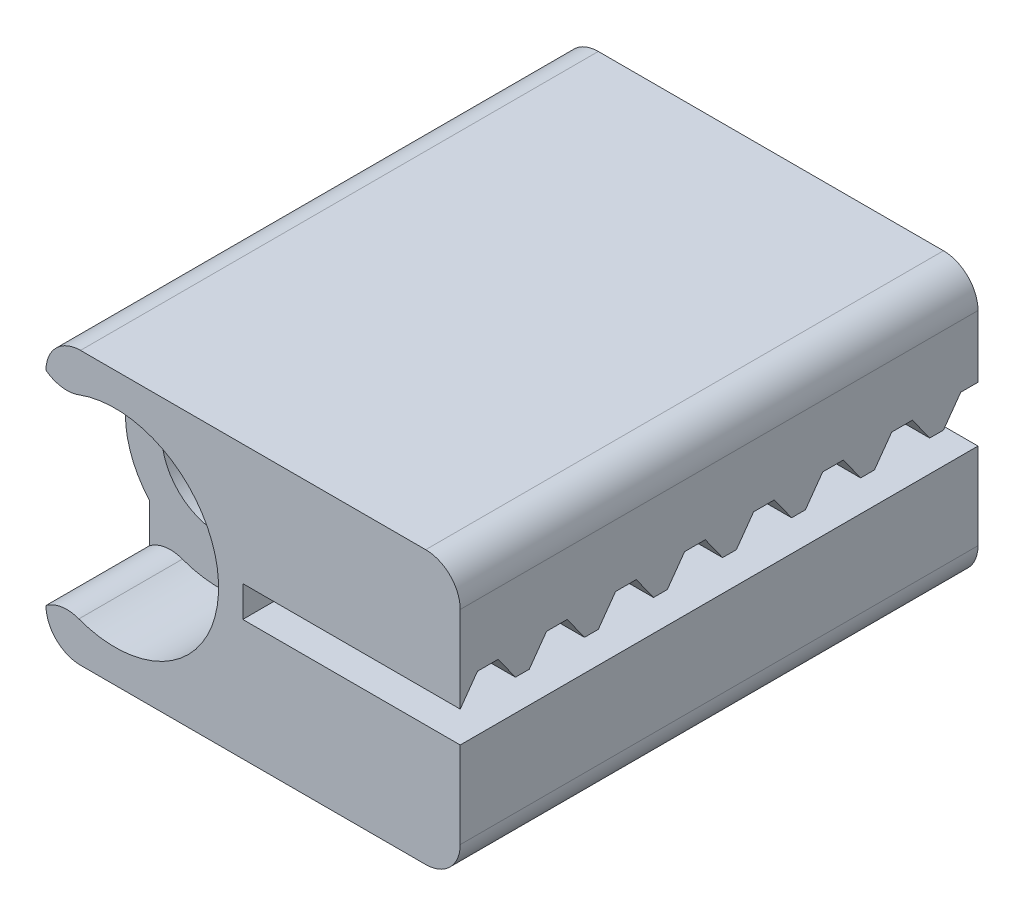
SolidWorks part; units mm, degrees
ref_plane "Спереди" through (0, 0, 0) normal (0, 0, 1) x (1, 0, 0)
ref_plane "Сверху" through (0, 0, 0) normal (0, 1, 0) x (1, 0, 0)
ref_plane "Справа" through (0, 0, 0) normal (1, 0, 0) x (0, 0, -1)
sketch "Эскиз1" plane through (0, 0, 0) normal (0, 0, 1) x (1, 0, 0)
  line L0 (0, 0) -> (0, 5.0449) construction
  line L1 (-5, -3.95) -> (5, -3.95)
  line L2 (-6, -2.95) -> (-6, -1.8138)
  line L3 (-5, 3.95) -> (5, 3.95)
  line L4 (6, -2.95) -> (6, 2.95)
  line L5 (-6, -3.95) -> (6, 3.95) construction
  line L6 (-6, 3.95) -> (6, -3.95) construction
  line L7 (0, 0) -> (-9.4958, 0) construction
  line L8 (-6, 1.8138) -> (-6, 2.95)
  arc A0 (-5, -3.95) -> (-6, -2.95) centre (-5, -2.95) cw
  arc A1 (5, -3.95) -> (6, -2.95) centre (5, -2.95) ccw
  arc A2 (5, 3.95) -> (6, 2.95) centre (5, 2.95) cw
  arc A3 (-6, 2.95) -> (-5, 3.95) centre (-5, 2.95) cw
  arc A4 (-6, 1.8138) -> (-6, -1.8138) centre (-4, 0) ccw
  circle A5 centre (-4, 0) radius 1.65
  point P0 (0, 0)
  dimension "D3" = 1
  dimension "D4" = 2.7
  dimension "D6" = 3.3
  dimension "D1" = 12
  dimension "D2" = 7.9
  dimension "D5" = 2
extrude "Бобышка-Вытянуть1" add sketch "Эскиз1" along normal blind 15
sketch "Эскиз2" plane through (0, 0, 15) normal (0, 0, 1) x (1, 0, 0)
  circle A0 centre (-4, 0) radius 3
  dimension "D1" = 6
extrude "Вырез-Вытянуть1" cut sketch "Эскиз2" against normal blind 3
fillet "Скругление1" radius 1 2 edges at (-6, -2.2361, 13.5) (-6, 2.2361, 13.5)
sketch "Эскиз3" plane through (0, 0, 15) normal (0, 0, 1) x (1, 0, 0)
  line L0 (-0.3, 0.45) -> (6, 0.45) construction
  line L2 (0, 0) -> (8.4498, 0) construction
  line L3 (6, 0.45) -> (-0.3, 0.45)
  line L4 (6, 0.45) -> (6, -0.45)
  line L5 (6, -0.45) -> (-0.3, -0.45)
  line L6 (-0.3, 0.45) -> (-0.3, -0.45)
  line L7 (6, -2.95) -> (6, 2.95) construction
  point P7 (-0.3, 0)
  dimension "D1" = 0.9
  dimension "D2" = 6.3
extrude "Вырез-Вытянуть2" cut sketch "Эскиз3" against normal through all
sketch "Эскиз4" plane through (6, 0, 0) normal (1, 0, 0) x (0, 0, -1)
  line L0 (-15, 0.45) -> (-14.5, 1.15)
  line L1 (-14.5, 1.15) -> (-13.9, 1.15)
  line L2 (-13.9, 1.15) -> (-13.4, 0.45)
  line L3 (0, 0.45) -> (-15, 0.45) construction
  line L4 (-13.4, 0.45) -> (-13, 0.45)
  line L5 (0, 0.45) -> (-15, 0.45) construction
  line L6 (-13, 0.45) -> (-12.5, 1.15)
  line L7 (-12.5, 1.15) -> (-11.9, 1.15)
  line L8 (-11.9, 1.15) -> (-11.4, 0.45)
  line L9 (-11.4, 0.45) -> (-11, 0.45)
  line L10 (-11, 0.45) -> (-10.5, 1.15)
  line L11 (-10.5, 1.15) -> (-9.9, 1.15)
  line L12 (-9.9, 1.15) -> (-9.4, 0.45)
  line L13 (-9.4, 0.45) -> (-9, 0.45)
  line L14 (-9, 0.45) -> (-8.5, 1.15)
  line L15 (-8.5, 1.15) -> (-7.9, 1.15)
  line L16 (-7.9, 1.15) -> (-7.4, 0.45)
  line L17 (-7.4, 0.45) -> (-7, 0.45)
  line L18 (-7, 0.45) -> (-6.5, 1.15)
  line L19 (-6.5, 1.15) -> (-5.9, 1.15)
  line L20 (-5.9, 1.15) -> (-5.4, 0.45)
  line L21 (-5.4, 0.45) -> (-5, 0.45)
  line L22 (-15, 0.45) -> (-15, -0.45)
  line L23 (-15, -0.45) -> (0, -0.45)
  line L24 (0, -0.45) -> (0, 1.15)
  line L25 (-5, 0.45) -> (-4.5, 1.15)
  line L26 (-4.5, 1.15) -> (-3.9, 1.15)
  line L27 (-3.9, 1.15) -> (-3.4, 0.45)
  line L28 (-3.4, 0.45) -> (-3, 0.45)
  line L29 (-3, 0.45) -> (-2.5, 1.15)
  line L30 (-2.5, 1.15) -> (-1.9, 1.15)
  line L31 (-1.9, 1.15) -> (-1.4, 0.45)
  line L32 (-1.4, 0.45) -> (-1, 0.45)
  line L33 (-1, 0.45) -> (-0.5, 1.15)
  line L34 (-0.5, 1.15) -> (0, 1.15)
  line L38 (0.6, 0.45) -> (1, 0.45)
  line L39 (0.1, 1.15) -> (0.6, 0.45)
  dimension "D1" = 0.6
  dimension "D2" = 1.6
  dimension "D3" = 0.7
  dimension "D4" = 0.4
  dimension "D5" = 8
extrude "Вырез-Вытянуть3" cut sketch "Эскиз4" against normal up to surface (6.3 mm away)
